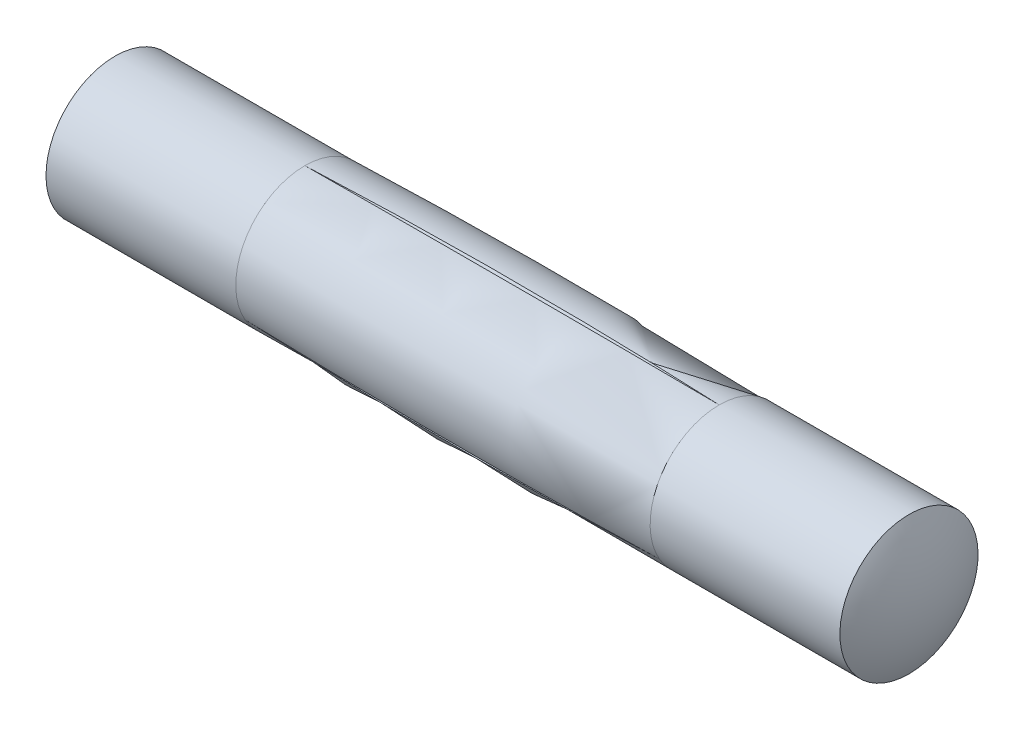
SolidWorks part; units mm, degrees
ref_plane "Plane1" through (0, 0, 0) normal (0, 0, 1) x (1, 0, 0)
ref_plane "Plane2" through (0, 0, 0) normal (0, 1, 0) x (1, 0, 0)
ref_plane "Plane3" through (0, 0, 0) normal (1, 0, 0) x (0, 0, -1)
other "Configuration Table"
sketch "Sketch1" plane through (0, 0, 0) normal (0, 0, 1) x (1, 0, 0)
  line L0 (-15, 0) -> (31.513, 0) construction
  line L1 (2.86, 0) -> (-2.86, 0) construction
  line L2 (-14.37, 2.5) -> (14.37, 2.5)
  line L3 (0, 19.94) -> (0, -13.9002) construction
  line L4 (0, -2.86) -> (0, 2.86) construction
  line L5 (-15, 0) -> (-15, -8.3947) construction
  line L6 (15, 0) -> (15, -8.3947) construction
  line L7 (-15, 0) -> (15, 0)
  arc A0 (-14.37, 2.5) -> (-15, 0) centre (-9.7247, 0) ccw
  arc A1 (14.37, 2.5) -> (15, 0) centre (9.7247, 0) cw
revolve "Revolve3" add sketch "Sketch1" angle 360 about L0
sketch "Sketch2" plane through (0, 0, 0) normal (0, 0, 1) x (1, 0, 0)
  line L0 (14.37, 2.5) -> (-14.37, 2.5) construction
  line L3 (0, 2.6) -> (6.8151, 2.6) construction
  line L4 (-7.5, 2.5) -> (-7.5, 0)
  line L5 (2.86, 0) -> (-2.86, 0) construction
  line L6 (-7.5, 0) -> (7.5, 0)
  line L7 (0, 2.6) -> (0, 0) construction
  line L8 (7.5, 2.5) -> (7.5, 0)
  line L9 (0, 0) -> (18.6878, 0) construction
  arc A0 (-7.5, 2.5) -> (7.5, 2.5) centre (0, -278.7) cw
revolve "Revolve4" add sketch "Sketch2" angle 360 about L9
sketch "Sketch3" plane through (0, 0, 0) normal (1, 0, 0) x (0, 0, -1)
  line L0 (0, 2.5) -> (-0.1147, 2.6638)
  line L1 (0, 2.9758) -> (0, -2.9758) construction
  line L2 (0, 2.5) -> (0, 2.9555) construction
  line L3 (0, 2.5) -> (0.1147, 2.6638)
  circle A0 centre (0, 0) radius 2.5 construction
  circle A1 centre (0, 0) radius 2.5 construction
  arc A2 (-0.1147, 2.6638) -> (0.1147, 2.6638) centre (0, 2.5) cw
extrude "Cut-Extrude1" cut sketch "Sketch3" against normal mid plane 15
pattern_circular "CirPattern2" count 3 over 360 about axis through (0, 0, 0) along (1, 0, 0) of "Cut-Extrude1"
equation "\"D1@Sketch3\" = \"d2@Sketch2\" - \"d@Sketch1\""
equation "\"D1@Cut-Extrude1\" = \"l2@Sketch2\""
